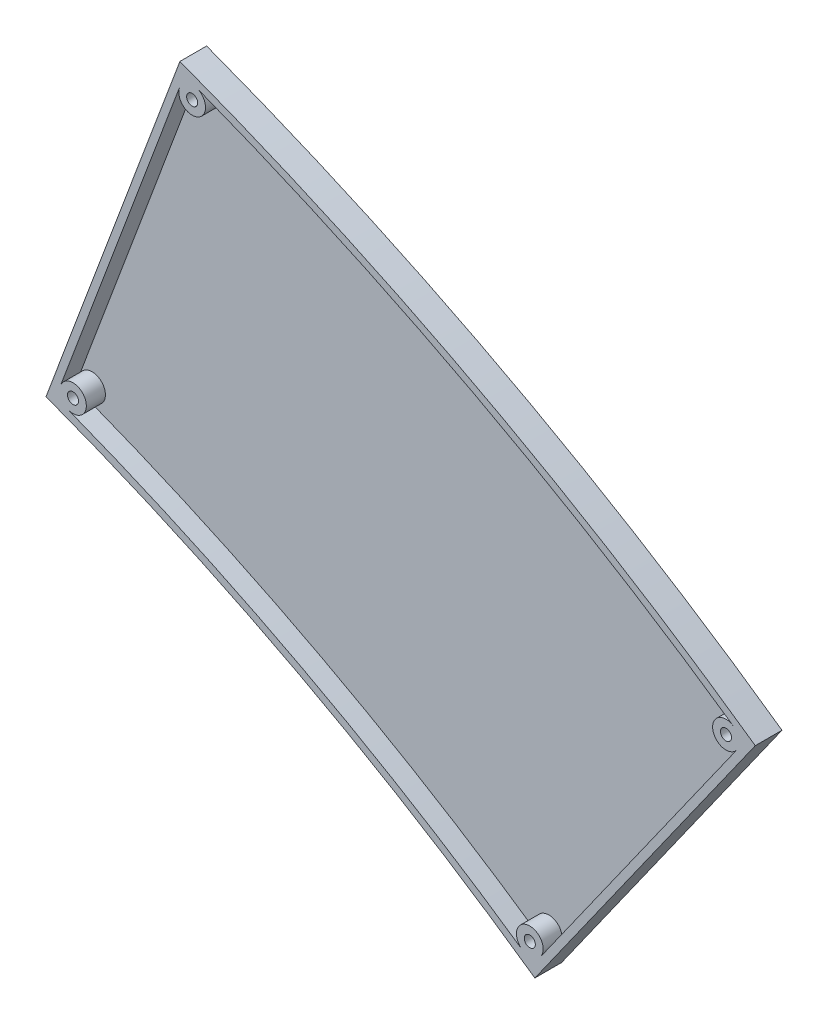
SolidWorks part; units mm, degrees
ref_plane "Front Plane" through (0, 0, 0) normal (0, 0, 1) x (1, 0, 0)
ref_plane "Top Plane" through (0, 0, 0) normal (0, 1, 0) x (1, 0, 0)
ref_plane "Right Plane" through (0, 0, 0) normal (1, 0, 0) x (0, 0, -1)
sketch "Sketch2" plane through (0, 0, 0) normal (0, 0, 1) x (1, 0, 0)
  line L0 (0, 0) -> (198.2974, 529.0587) construction
  line L1 (0, 0) -> (326.4209, 461.1664) construction
  line L2 (198.2974, 529.0587) -> (233.3943, 622.6975)
  line L3 (326.4209, 461.1664) -> (384.1945, 542.7887)
  arc A1 (326.4209, 461.1664) -> (198.2974, 529.0587) centre (0, 0) ccw
  arc A2 (384.1945, 542.7887) -> (233.3943, 622.6975) centre (0, 0) ccw
  dimension "D1" = 1330
  dimension "D2" = 100
  dimension "D3" = 145
extrude "Boss-Extrude1" add sketch "Sketch2" against normal blind 2
sketch "Sketch4" plane through (0, 0, 0) normal (0, 0, 1) x (1, 0, 0)
  line L0 (233.3943, 622.6975) -> (198.2974, 529.0587)
  line L1 (326.4209, 461.1664) -> (384.1945, 542.7887)
  arc A0 (198.2974, 529.0587) -> (326.4209, 461.1664) centre (0, 0) cw
  arc A1 (384.1945, 542.7887) -> (233.3943, 622.6975) centre (0, 0) ccw
extrude "Extrude-Thin1" add sketch "Sketch4" along normal blind 5 thin
sketch "Sketch8" plane through (0, 0, 0) normal (0, 0, 1) x (1, 0, 0)
  line L0 (325.9418, 463.9514) -> (381.4048, 542.3093) construction
  line L1 (381.4048, 542.3093) -> (379.3712, 539.4363)
  line L3 (234.564, 620.1199) -> (233.3287, 616.8239)
  line L4 (202.0912, 533.4821) -> (200.8708, 530.2263)
  line L5 (327.9506, 466.7894) -> (325.9418, 463.9514)
  arc A0 (378.5126, 544.3319) -> (379.3712, 539.4363) centre (376.5144, 541.4583) ccw
  arc A1 (233.3287, 616.8239) -> (237.8617, 618.8625) centre (236.606, 615.5955) ccw
  arc A2 (325.9418, 463.9514) -> (200.8708, 530.2263) centre (0, 0) ccw construction
  arc A4 (381.4048, 542.3093) -> (234.564, 620.1199) centre (0, 0) ccw construction
  arc A5 (204.1086, 528.9884) -> (202.0912, 533.4821) centre (205.3685, 532.2537) ccw
  arc A6 (327.9506, 466.7894) -> (323.0994, 465.9354) centre (325.0939, 468.8115) ccw
  arc A7 (237.8617, 618.8625) -> (234.564, 620.1199) centre (0, 0) ccw
  arc A8 (381.4048, 542.3093) -> (378.5126, 544.3319) centre (0, 0) ccw
  arc A10 (325.9418, 463.9514) -> (323.0994, 465.9354) centre (0, 0) ccw
  arc A11 (204.1086, 528.9884) -> (200.8708, 530.2263) centre (0, 0) ccw
extrude "Boss-Extrude15" add sketch "Sketch8" along normal blind 5
sketch "Sketch14" plane through (0, 0, 5) normal (0, 0, 1) x (1, 0, 0)
  circle A0 centre (236.606, 615.5955) radius 3.5
  circle A1 centre (205.3685, 532.2537) radius 3.5
  circle A2 centre (325.0939, 468.8115) radius 3.5
  circle A3 centre (376.5144, 541.4583) radius 3.5
extrude "Cut-Extrude7" cut sketch "Sketch14" along normal blind 1.5 from surface at -7
sketch "Sketch15" plane through (0, 0, -0.5) normal (0, 0, -1) x (-1, 0, 0)
  circle A0 centre (-376.5144, 541.4583) radius 1.45
  circle A1 centre (-325.0939, 468.8115) radius 1.45
  circle A2 centre (-205.3685, 532.2537) radius 1.45
  circle A3 centre (-236.606, 615.5955) radius 1.45
extrude "Cut-Extrude8" cut sketch "Sketch15" against normal through all
